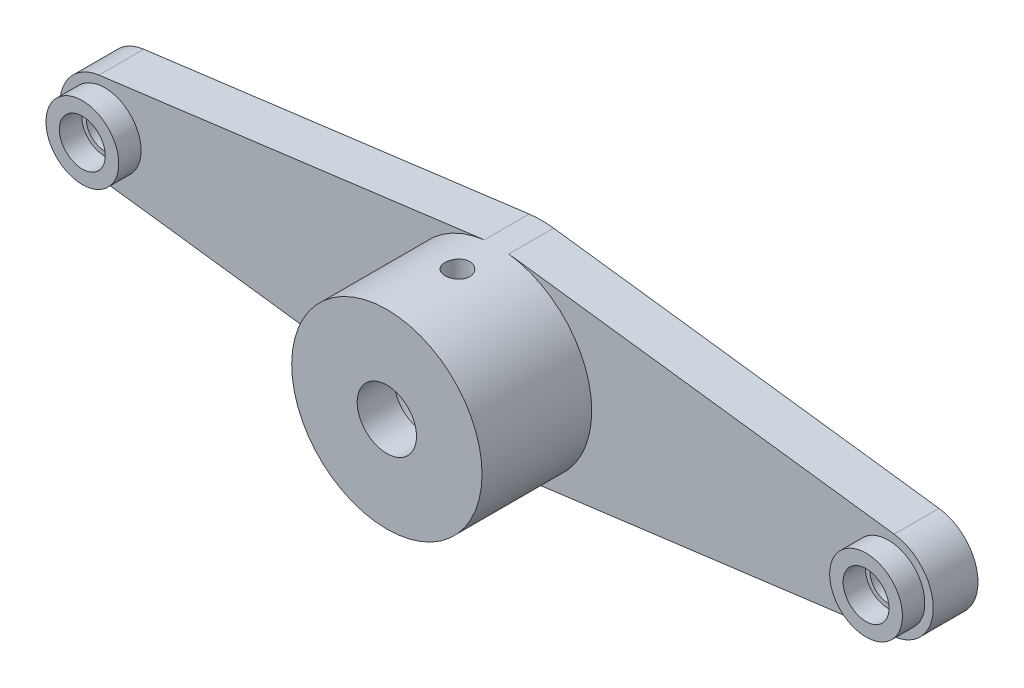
SolidWorks part; units mm, degrees
ref_plane "前视基准面" through (0, 0, 0) normal (0, 0, 1) x (1, 0, 0)
ref_plane "上视基准面" through (0, 0, 0) normal (0, 1, 0) x (1, 0, 0)
ref_plane "右视基准面" through (0, 0, 0) normal (1, 0, 0) x (0, 0, -1)
sketch "草图1" plane through (0, 0, 0) normal (0, 0, 1) x (1, 0, 0)
  line L0 (0, 0) -> (-35, 0) construction
  line L1 (0, 0) -> (0, 20.1334) construction
  line L2 (-35.5143, 3.9668) -> (-1.0929, 8.4295)
  line L3 (-35.5143, -3.9668) -> (-1.0929, -8.4295)
  line L4 (35.5143, -3.9668) -> (1.0929, -8.4295)
  line L5 (35.5143, 3.9668) -> (1.0929, 8.4295)
  arc A0 (1.0929, 8.4295) -> (-1.0929, 8.4295) centre (0, 0) ccw
  circle A1 centre (0, 0) radius 5.25
  circle A2 centre (-35, 0) radius 1
  arc A3 (-35.5143, 3.9668) -> (-35.5143, -3.9668) centre (-35, 0) ccw
  circle A4 centre (35, 0) radius 1
  arc A5 (35.5143, 3.9668) -> (35.5143, -3.9668) centre (35, 0) cw
  arc A6 (-1.0929, -8.4295) -> (1.0929, -8.4295) centre (0, 0) ccw
  dimension "D2" = 10.5
  dimension "D3" = 17
  dimension "D4" = 2
  dimension "D5" = 8
  dimension "D1" = 35
extrude "凸台-拉伸1" add sketch "草图1" along normal blind 4
sketch "草图4" plane through (0, 0, 4) normal (0, 0, 1) x (1, 0, 0)
  point P0 (-35, 0)
  point P1 (35, 0)
hole_wizard "M4 螺纹孔1" positions "3D草图4" profile "草图5" tap size "M4" standard "GB"
sketch3d "3D草图4"
  point P0 (-35, 0, 4)
  point P3 (35, 0, 4)
sketch "草图5" plane through (-35, 0, 4) normal (1, 0, 0) x (0, -1, 0)
  line L0 (0, 0) -> (0, 4)
  line L1 (0, 4) -> (1.65, 4)
  line L2 (1.65, 4) -> (1.65, 0)
  line L5 (1.65, 0) -> (0, 0)
  line L11 (0, -6.35) -> (0, 107.95) construction
  dimension "通孔螺纹孔钻头直径" = 3.3
  dimension "通孔螺纹孔钻头深度" = 4
sketch "草图6" plane through (0, 0, 4) normal (0, 0, 1) x (1, 0, 0)
  circle A0 centre (0, 0) radius 5.25
  circle A1 centre (0, 0) radius 8.5
extrude "凸台-拉伸2" add sketch "草图6" along normal blind 9.8
sketch "草图7" plane through (0, 0, 13.8) normal (0, 0, 1) x (1, 0, 0)
  circle A0 centre (0, 0) radius 2.65
  circle A1 centre (0, 0) radius 5.25 construction
  circle A2 centre (0, 0) radius 5.25
  dimension "D1" = 5.3
extrude "凸台-拉伸3" add sketch "草图7" against normal blind 3.3
sketch "草图8" plane through (0, 0, 0) normal (0, 1, 0) x (1, 0, 0)
  line L0 (-29.3723, -7.5) -> (19.2944, -7.5) construction
  line L1 (5.25, -10.5) -> (-5.25, -10.5) construction
  line L2 (0, 0) -> (0, -13.8) construction
  line L3 (-8.5, -13.8) -> (8.5, -13.8) construction
  circle A0 centre (0, -7.5) radius 1.1
  point P9 (0, -7.5)
  dimension "D2" = 2.2
  dimension "D1" = 3
extrude "切除-拉伸1" cut sketch "草图8" against normal mid plane 33.3
sketch "草图9" plane through (0, 0, 4) normal (0, 0, 1) x (1, 0, 0)
  line L0 (0, 0) -> (0, 12.3585) construction
  circle A0 centre (-35, 0) radius 2.05
  circle A1 centre (-35, 0) radius 3.25
  circle A2 centre (35, 0) radius 2.05
  circle A3 centre (35, 0) radius 3.25
  dimension "D1" = 4.1
  dimension "D2" = 6.5
extrude "凸台-拉伸4" add sketch "草图9" along normal blind 2
